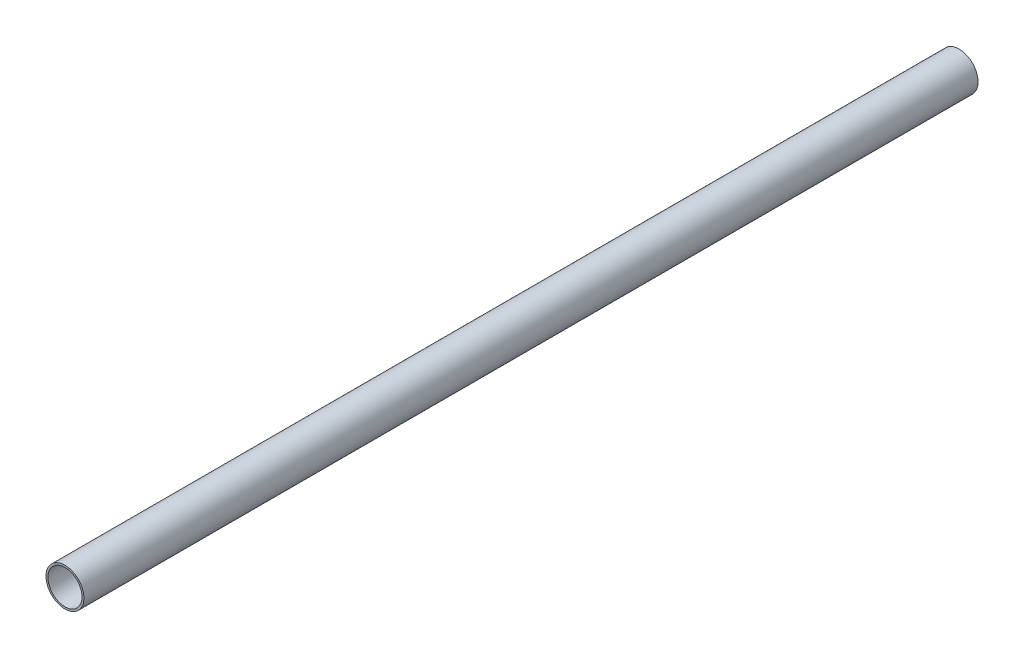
SolidWorks part; units mm, degrees
ref_plane "Front Plane" through (0, 0, 0) normal (0, 0, 1) x (1, 0, 0)
ref_plane "Top Plane" through (0, 0, 0) normal (0, 1, 0) x (1, 0, 0)
ref_plane "Right Plane" through (0, 0, 0) normal (1, 0, 0) x (0, 0, -1)
imported_body "Imported1"
sketch "Sketch1" plane through (0, 0, 0) normal (0, 0, 1) x (1, 0, 0)
  circle A0 centre (0, 0) radius 30 construction
  circle A1 centre (0, 0) radius 30
extrude "Cut-Extrude1" cut sketch "Sketch1" against normal mid plane 171.32
move or copy body "Body-Move/Copy1" bodies to move or copy 103 placed by mates yes
combine bodies "Combine1" operation type add bodies to combine 104 102
ref_plane "Plane1" through (0, 0, -283.06) normal (0, 0, 1) x (1, 0, 0)
